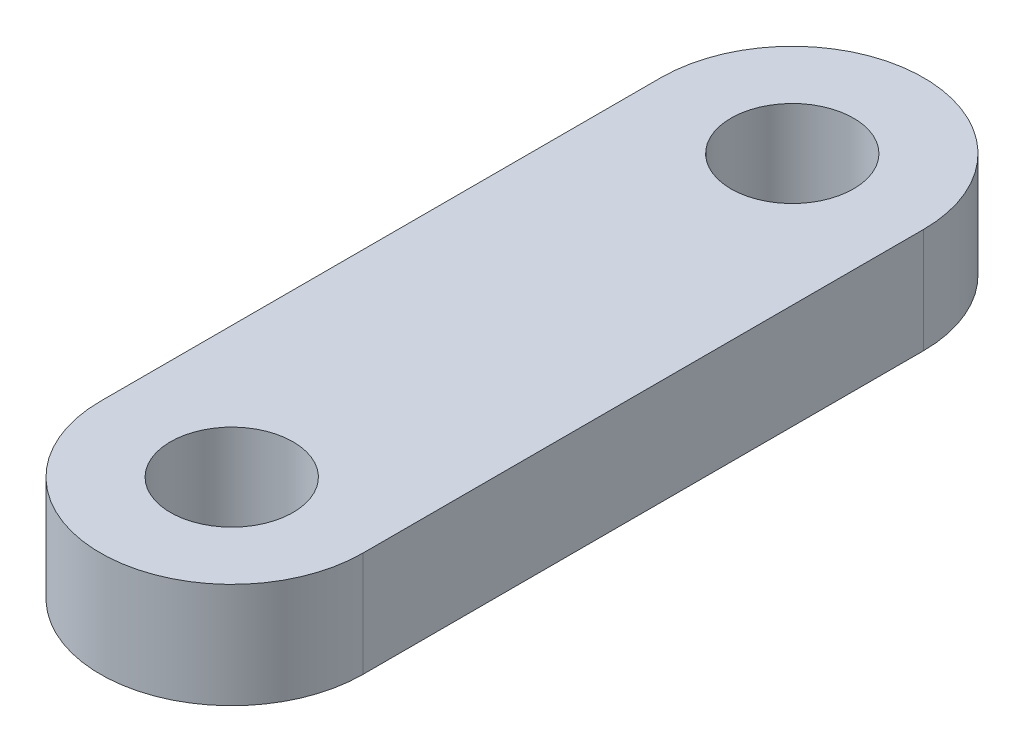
SolidWorks part; units mm, degrees
ref_plane "Front" through (0, 0, 0) normal (0, 0, 1) x (1, 0, 0)
ref_plane "Top" through (0, 0, 0) normal (0, 1, 0) x (1, 0, 0)
ref_plane "Right" through (0, 0, 0) normal (1, 0, 0) x (0, 0, -1)
sketch "Sketch1" plane through (0, 0, 0) normal (0, 1, 0) x (1, 0, 0)
  line L0 (0, 9.75) -> (-7.5377, 9.75) construction
  line L1 (-3.75, 8) -> (3.75, 8) construction
  line L2 (-3.75, 8) -> (-3.75, 0)
  line L3 (-3.75, 0) -> (3.75, 0)
  line L4 (3.75, 8) -> (3.75, 0)
  line L5 (0, 11.75) -> (-7.5377, 11.75) construction
  circle A0 centre (0, 8) radius 1.75
  arc A1 (-3.75, 8) -> (3.75, 8) centre (0, 8) cw
  point P4 (0, 0)
  dimension "D1" = 3.5
  dimension "D2" = 2
  dimension "D3" = 8
extrude "Boss-Extrude1" add sketch "Sketch1" along normal blind 3
mirror "Mirror1" about plane through (-3.75, 3, 0) normal (0, 0, -1)
